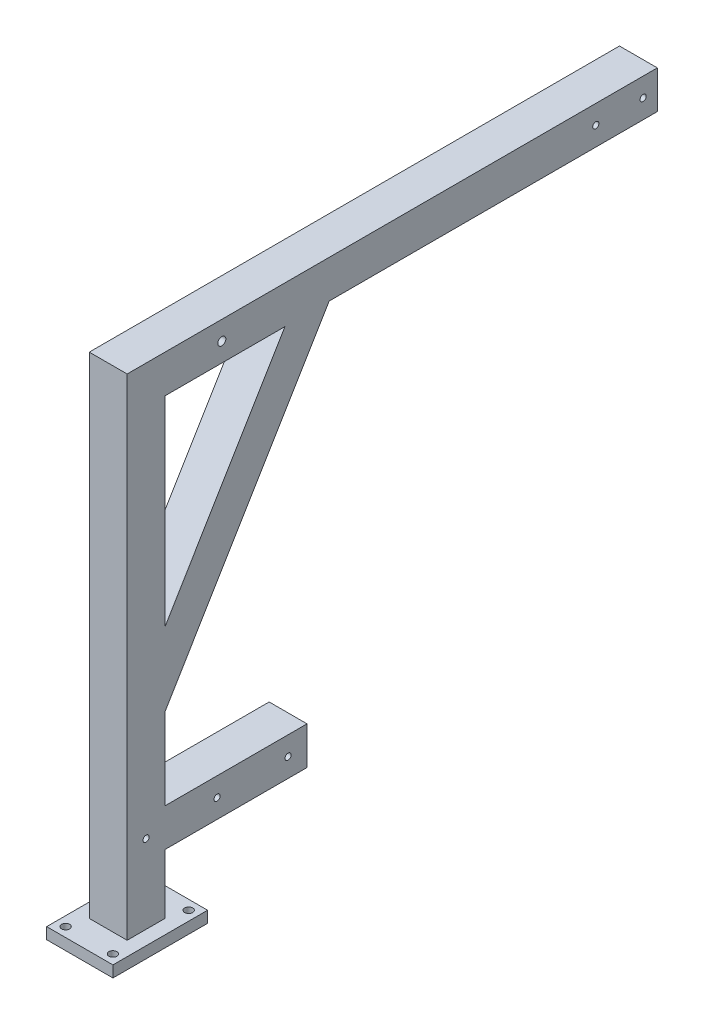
SolidWorks part; units mm, degrees
ref_plane "前视基准面" through (0, 0, 0) normal (0, 0, 1) x (1, 0, 0)
ref_plane "上视基准面" through (0, 0, 0) normal (0, 1, 0) x (1, 0, 0)
ref_plane "右视基准面" through (0, 0, 0) normal (1, 0, 0) x (0, 0, -1)
sketch "草图2" plane through (0, 0, 0) normal (0, 0, 1) x (1, 0, 0)
  line L0 (55, 12) -> (55, 490)
  line L1 (15, 12) -> (15, 490)
  line L2 (55, 490) -> (55, 530)
  line L3 (55, 530) -> (15, 530)
  line L4 (15, 530) -> (15, 490)
  line L5 (70, 0) -> (0, 0)
  line L6 (70, 12) -> (55, 12)
  line L7 (0, 0) -> (0, 12)
  line L8 (70, 0) -> (70, 12)
  line L9 (15, 12) -> (0, 12)
extrude "凸台-拉伸1" add sketch "草图2" along normal blind 590
sketch "草图4" plane through (0, 530, 0) normal (0, 1, 0) x (1, 0, 0)
  line L0 (70, -490) -> (70, -590)
  line L1 (0, -590) -> (0, -490)
  line L2 (70, -590) -> (0, -590)
  line L3 (70, -490) -> (55, -490)
  line L4 (15, 0) -> (55, 0)
  line L5 (15, 0) -> (15, -490)
  line L6 (55, 0) -> (55, -490)
  line L7 (15, -490) -> (0, -490)
  circle A0 centre (10, -580) radius 4.25
  circle A1 centre (60, -580) radius 4.25
  circle A2 centre (60, -500) radius 4.25
  circle A3 centre (10, -500) radius 4.25
extrude "切除-拉伸1" cut sketch "草图4" against normal through all flip side to cut
sketch "草图5" plane through (70, 0, 0) normal (1, 0, 0) x (0, 0, -1)
  line L0 (-560, 12) -> (-560, 490)
  line L1 (-520, 12) -> (-520, 75)
  line L2 (0, 530) -> (-560, 530)
  line L3 (0, 490) -> (-346.6762, 490)
  line L4 (-560, 530) -> (-560, 490)
  line L5 (0, 530) -> (0, 490)
  line L6 (-520, 115) -> (-370, 115)
  line L7 (-520, 75) -> (-370, 75)
  line L8 (-370, 75) -> (-370, 115)
  line L9 (-346.6762, 490) -> (-520, 201.127)
  line L10 (-393.3238, 490) -> (-520, 278.873)
  line L11 (-590, 12) -> (-590, 0)
  line L12 (-490, 0) -> (-490, 12)
  line L13 (-590, 12) -> (-560, 12)
  line L14 (-590, 0) -> (-490, 0)
  line L15 (-393.3238, 490) -> (-520, 490)
  line L16 (-520, 278.873) -> (-520, 490)
  line L17 (-520, 115) -> (-520, 201.127)
  line L18 (-520, 12) -> (-490, 12)
  circle A0 centre (-390, 95) radius 3.25
  circle A1 centre (-465, 95) radius 3.25
  circle A2 centre (-540, 95) radius 3.25
  circle A3 centre (-460, 510) radius 4.25
  circle A4 centre (-15, 510) radius 3.25
  circle A5 centre (-65, 510) radius 3.25
extrude "切除-拉伸2" cut sketch "草图5" against normal blind 590 flip side to cut
